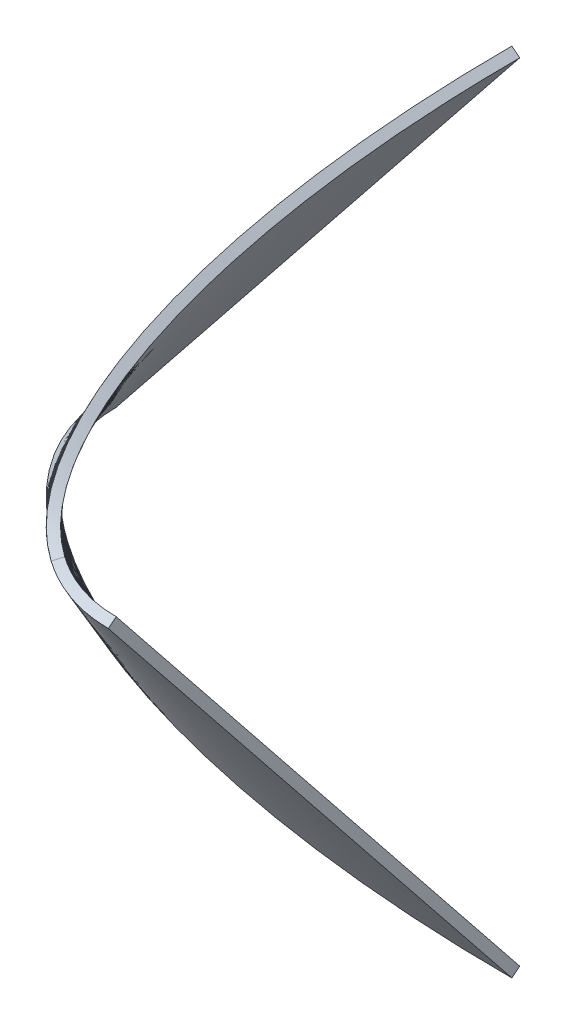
SolidWorks part; units mm, degrees
ref_plane "Ebene vorne" through (0, 0, 0) normal (0, 0, 1) x (1, 0, 0)
ref_plane "Ebene oben" through (0, 0, 0) normal (0, 1, 0) x (1, 0, 0)
ref_plane "Ebene rechts" through (0, 0, 0) normal (1, 0, 0) x (0, 0, -1)
sketch "Skizze1" plane through (0, 0, 0) normal (0, 1, 0) x (1, 0, 0)
  line L0 (-59.7044, -15.6612) -> (-82.071, 0) construction
  line L1 (-82.071, 0) -> (0, 0) construction
  ellipse E0 centre (0, 0) end of major axis (-70, 0) minor radius 30 (-70, 0) -> (-59.7044, -15.6612) ccw
  ellipse E1 centre (0, 0) end of major axis (-70, 0) minor radius 30 (-59.7044, -15.6612) -> (0, -30) ccw
  dimension "D1" = 30
  dimension "D2" = 70
  dimension "D3" = 35
ref_plane "Ebene1" through (0, 50, 0) normal (0, 1, 0) x (-1, 0, 0)
sketch "Skizze2" plane through (0, 50, 0) normal (0, 1, 0) x (-1, 0, 0)
  line L0 (0, 0) -> (104.3747, 0) construction
  line L1 (8.6228, 67.0462) -> (104.3747, 0) construction
  ellipse E0 centre (0, 0) end of major axis (0, 70) minor radius 30 (30, 0) -> (8.6228, 67.0462) ccw
  ellipse E1 centre (0, 0) end of major axis (0, 70) minor radius 30 (8.6228, 67.0462) -> (0, 70) ccw
  dimension "D1" = 30
  dimension "D2" = 70
  dimension "D3" = 35
sheet metal parameters "Blech2" thickness 1 parameters "D1"=10, "Dicke"=1
lofted bend "Ausgeformte Biegungen1" parameters "D1"=0, "D12"=1
other "Freiform-Biegung1" parameters "D1"=1000, "D4"=57.296, "D5"=1
other "Freiform-Biegung2" parameters "D1"=1000, "D4"=57.296, "D5"=2
flat pattern "Abwicklung1"
sketch "Biegung-Linien1" plane through (0, -14.6341, 18.2927) normal (0, -0.6247, 0.7809) x (1, 0, 0)
  line L0 (-8.7824, 81.1222) -> (-61.132, 10.346) construction
  line L1 (-11.0611, 80.3656) -> (-62.9775, 9.7446) construction
  line L2 (-13.464, 79.5498) -> (-64.4256, 9.2627) construction
  line L3 (-15.994, 78.6944) -> (-65.6676, 8.8448) construction
  line L4 (-18.658, 77.8354) -> (-66.7809, 8.4661) construction
  line L5 (-21.4857, 76.9684) -> (-67.8152, 8.1092) construction
  line L6 (-24.4862, 76.1101) -> (-68.7857, 7.7753) construction
  line L7 (-27.6603, 75.2909) -> (-69.7095, 7.4633) construction
  line L8 (-31.043, 74.4826) -> (-70.5976, 7.17) construction
  line L9 (-34.6376, 73.7041) -> (-71.4556, 6.9004) construction
  line L10 (-38.4438, 72.9812) -> (-72.2887, 6.658) construction
  line L11 (-42.48, 72.2919) -> (-73.1145, 6.4182) construction
  line L12 (-46.7299, 71.6678) -> (-73.9242, 6.2073) construction
  line L13 (-51.1828, 71.1131) -> (-74.7207, 6.0301) construction
  line L14 (-55.8043, 70.6274) -> (-75.5137, 5.8693) construction
  line L15 (-60.5493, 70.2238) -> (-76.302, 5.7367) construction
  line L16 (-65.3541, 69.9062) -> (-77.0867, 5.6341) construction
  line L17 (-70.1432, 69.6937) -> (-77.8698, 5.5593) construction
  line L18 (-74.8558, 69.5708) -> (-78.6526, 5.5153) construction
  line L19 (-79.457, 69.5285) -> (-79.4561, 5.4972) construction
  line L20 (0, 82.7721) -> (0, 18.7409) construction
  line L21 (-0.6981, 82.7546) -> (-4.3031, 18.7041) construction
  line L22 (-1.3665, 82.724) -> (-8.8225, 18.5876) construction
  line L23 (-2.0041, 82.6749) -> (-13.4731, 18.394) construction
  line L24 (-2.6163, 82.5986) -> (-18.1446, 18.1021) construction
  line L25 (-3.2017, 82.519) -> (-22.7054, 17.7345) construction
  line L26 (-3.7653, 82.4278) -> (-27.0673, 17.2934) construction
  line L27 (-4.3116, 82.3197) -> (-31.1713, 16.804) construction
  line L28 (-4.8349, 82.2137) -> (-34.985, 16.2808) construction
  line L29 (-5.3438, 82.0963) -> (-38.525, 15.7175) construction
  line L30 (-5.8296, 81.9831) -> (-41.7951, 15.1463) construction
  line L31 (-6.3062, 81.8565) -> (-44.8214, 14.5663) construction
  line L32 (-6.7662, 81.7255) -> (-47.6387, 13.9634) construction
  line L33 (-7.202, 81.601) -> (-50.2558, 13.3655) construction
  line L34 (-7.6198, 81.4802) -> (-52.6986, 12.7668) construction
  line L35 (-8.0002, 81.372) -> (-54.9953, 12.155) construction
  line L36 (-8.336, 81.2664) -> (-57.1507, 11.5496) construction
  line L37 (-8.6133, 81.1772) -> (-59.1795, 10.9514) construction
  line L38 (-8.7824, 81.1222) -> (-61.132, 10.346) construction
other "Abwickeln-<Freiform-Biegung1>1"
other "Abwickeln-<Freiform-Biegung2>1"
sketch "Skizze3" [suppressed] plane through (0, -14.0095, 17.5118) normal (0, 0.6247, -0.7809) x (-1, 0, 0)
  line L2 (8.7824, 81.1222) -> (61.132, 10.346) construction
  line L3 (79.457, 69.5285) -> (79.4561, 5.4972) construction
  line L4 (22.5996, 76.6412) -> (64.729, 9.1609) construction
  line L5 (33.5538, 73.9287) -> (67.7329, 8.1377) construction
  line L6 (42.8237, 72.2376) -> (70.2835, 7.2725) construction
  line L7 (51.0627, 71.1274) -> (72.4752, 6.6065) construction
  line L8 (58.6393, 70.3769) -> (74.4188, 6.0927) construction
  line L9 (65.7872, 69.8831) -> (76.1842, 5.752) construction
  line L10 (72.6766, 69.6208) -> (77.8435, 5.5609) construction
  line L11 (57.5871, 15.1388) -> (60.0406, 16.6706) construction
  line L12 (60.0406, 16.6706) -> (62.6073, 18.004) construction
  line L13 (62.6073, 18.004) -> (65.2715, 19.1301) construction
  line L14 (65.2715, 19.1301) -> (68.0167, 20.0412) construction
  line L15 (68.0167, 20.0412) -> (70.8257, 20.7307) construction
  line L16 (70.8257, 20.7307) -> (73.6808, 21.1936) construction
  line L17 (73.6808, 21.1936) -> (76.5639, 21.4261) construction
  line L18 (76.5639, 21.4261) -> (79.4563, 21.4261) construction
  spline S2 degree 3 number of poles 98 (8.7824, 81.1222) -> (79.457, 69.5285) construction
  spline S3 degree 3 number of poles 154 (61.132, 10.346) -> (79.4561, 5.4972) construction
  point P4 (79.4558, -14.4274)
